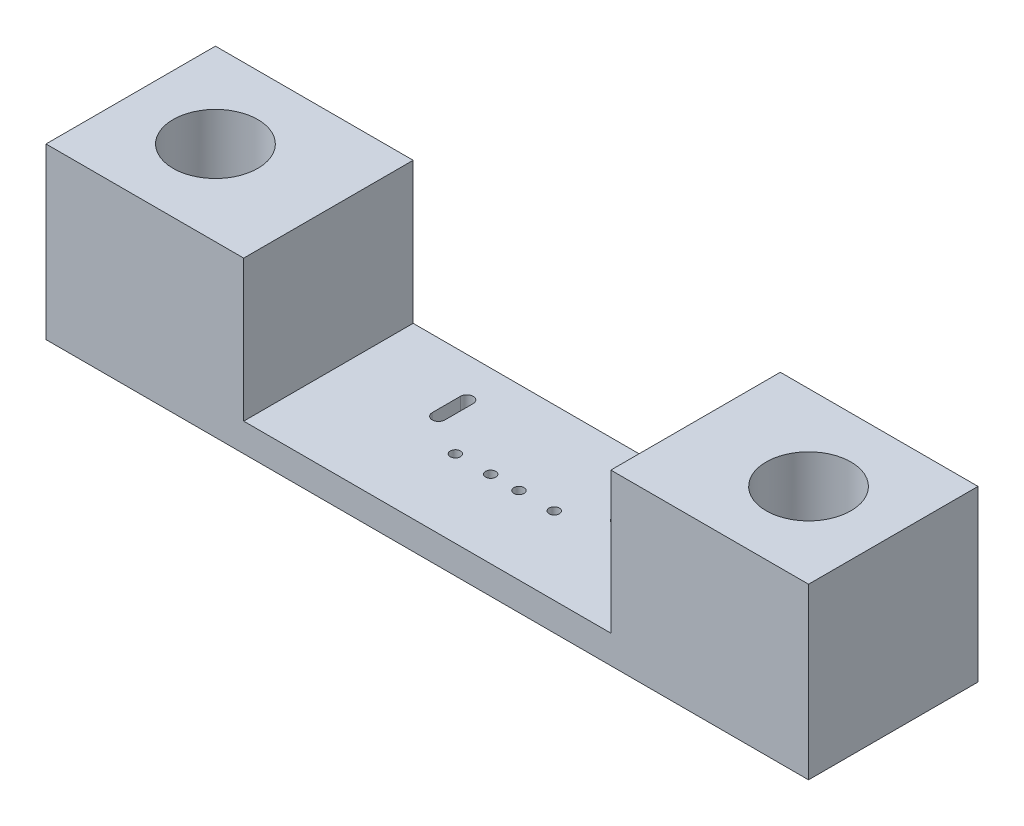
SolidWorks part; units mm, degrees
ref_plane "前视基准面" through (0, 0, 0) normal (0, 0, 1) x (1, 0, 0)
ref_plane "上视基准面" through (0, 0, 0) normal (0, 1, 0) x (1, 0, 0)
ref_plane "右视基准面" through (0, 0, 0) normal (1, 0, 0) x (0, 0, -1)
sketch "草图1" plane through (0, 0, 0) normal (0, 0, 1) x (1, 0, 0)
  line L0 (0, 0) -> (54, 0)
  line L1 (14, 2) -> (40, 2)
  line L2 (0, 0) -> (0, 12)
  line L3 (54, 0) -> (54, 12)
  line L4 (0, 12) -> (14, 12)
  line L5 (14, 2) -> (14, 12)
  line L6 (40, 2) -> (40, 12)
  line L7 (40, 12) -> (54, 12)
extrude "凸台-拉伸1" add sketch "草图1" along normal blind 12
sketch "草图2" plane through (0, 12, 0) normal (0, 1, 0) x (1, 0, 0)
  line L0 (33.85, -4.8) -> (33.85, -2.8)
  line L1 (32.95, -4.8) -> (32.95, -2.8)
  line L2 (21.05, -4.8) -> (21.05, -2.8)
  line L3 (20.15, -4.8) -> (20.15, -2.8)
  line L4 (54, 0) -> (0, 0)
  line L5 (54, -12) -> (0, -12)
  line L6 (0, 0) -> (0, -12)
  line L7 (54, 0) -> (54, -12)
  arc A0 (32.95, -4.8) -> (33.85, -4.8) centre (33.4, -4.8) ccw
  arc A1 (33.85, -2.8) -> (32.95, -2.8) centre (33.4, -2.8) ccw
  arc A2 (21.05, -2.8) -> (20.15, -2.8) centre (20.6, -2.8) ccw
  arc A3 (20.15, -4.8) -> (21.05, -4.8) centre (20.6, -4.8) ccw
  circle A4 centre (30.5, -6.51) radius 0.36
  circle A5 centre (28, -6.51) radius 0.36
  circle A6 centre (26, -6.51) radius 0.36
  circle A7 centre (23.5, -6.51) radius 0.36
  circle A8 centre (6, -6) radius 1.75
  circle A9 centre (48, -6) radius 1.75
extrude "切除-拉伸1" cut sketch "草图2" against normal through all flip side to cut
sketch "草图3" plane through (0, 12, 0) normal (0, 1, 0) x (1, 0, 0)
  circle A0 centre (6, -6) radius 3
  circle A1 centre (48, -6) radius 3
extrude "切除-拉伸2" cut sketch "草图3" against normal blind 6
sketch "草图4" plane through (0, 12, 0) normal (0, 1, 0) x (1, 0, 0)
  circle A0 centre (6, -6) radius 3.25 construction
  circle A1 centre (48, -6) radius 3.25 construction
sketch "草图5" plane through (0, 0, 0) normal (0, -1, 0) x (1, 0, 0)
  circle A0 centre (6, 6) radius 3.25
  circle A1 centre (48, 6) radius 3.25
extrude "切除-拉伸3" cut sketch "草图5" against normal blind 6
